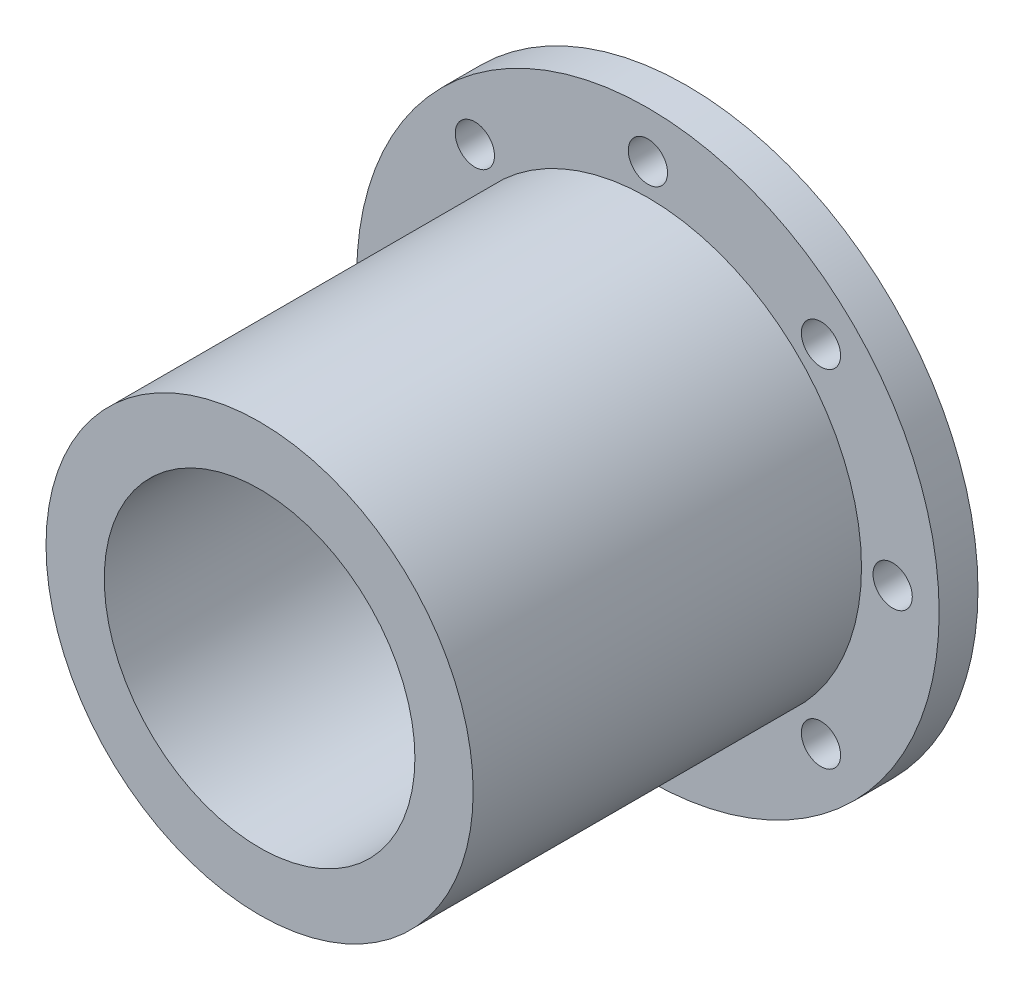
SolidWorks part; units mm, degrees
ref_plane "Front Plane" through (0, 0, 0) normal (0, 0, 1) x (1, 0, 0)
ref_plane "Top Plane" through (0, 0, 0) normal (0, 1, 0) x (1, 0, 0)
ref_plane "Right Plane" through (0, 0, 0) normal (1, 0, 0) x (0, 0, -1)
sketch "Sketch1" plane through (0, 0, 0) normal (0, 0, 1) x (1, 0, 0)
  circle A0 centre (0, 0) radius 75
  circle A1 centre (0, 0) radius 55
  circle A2 centre (0, 0) radius 40
  dimension "D1" = 150
  dimension "D2" = 110
  dimension "D3" = 80
extrude "Boss-Extrude2" add sketch "Sketch1" along normal blind 100 contours A1 A2
sketch "Sketch2" plane through (0, 0, 0) normal (0, 0, 1) x (1, 0, 0)
  circle A0 centre (0, 0) radius 75
  circle A1 centre (0, 0) radius 55
  dimension "D1" = 150
extrude "Boss-Extrude3" add sketch "Sketch2" against normal blind 10 separate body
sketch "Sketch4" plane through (0, 0, 0) normal (0, 0, 1) x (1, 0, 0)
  circle A0 centre (0, 63.0237) radius 5.0545
  circle A1 centre (44.5645, 44.5645) radius 5.0545
  circle A2 centre (63.0237, 0) radius 5.0545
  circle A3 centre (44.5645, -44.5645) radius 5.0545
  circle A4 centre (0, -63.0237) radius 5.0545
  circle A5 centre (-44.5645, -44.5645) radius 5.0545
  circle A6 centre (-63.0237, 0) radius 5.0545
  circle A7 centre (-44.5645, 44.5645) radius 5.0545
  point P19 (0, 0)
  dimension "D1" = 8
extrude "Cut-Extrude1" cut sketch "Sketch4" against normal blind 10
